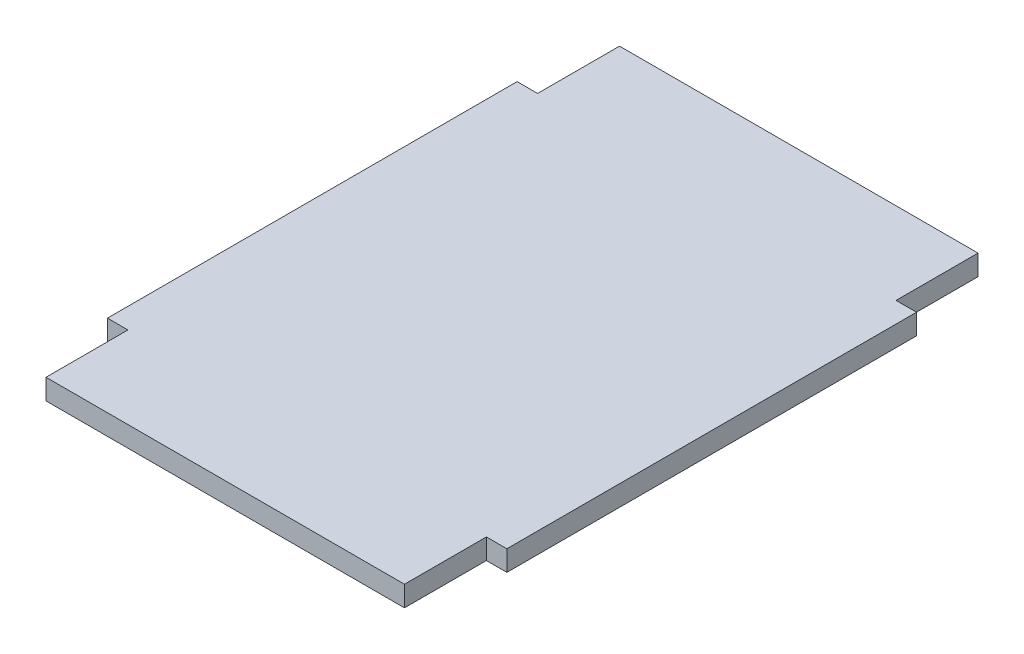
SolidWorks part; units mm, degrees
ref_plane "Front" through (0, 0, 0) normal (0, 0, 1) x (1, 0, 0)
ref_plane "Top" through (0, 0, 0) normal (0, 1, 0) x (1, 0, 0)
ref_plane "Right" through (0, 0, 0) normal (1, 0, 0) x (0, 0, -1)
sketch "草图1" plane through (0, 0, 0) normal (0, 1, 0) x (1, 0, 0)
  line L1 (0, 0) -> (35, 0)
  line L2 (0, 0) -> (0, 56)
  line L3 (0, 56) -> (35, 56)
  line L4 (35, 0) -> (35, 56)
  line L5 (0, 48) -> (-2, 48)
  line L6 (0, 48) -> (0, 8)
  line L7 (0, 8) -> (-2, 8)
  line L8 (-2, 48) -> (-2, 8)
  line L9 (35, 48) -> (37, 48)
  line L10 (35, 48) -> (35, 8)
  line L11 (35, 8) -> (37, 8)
  line L12 (37, 48) -> (37, 8)
  dimension "D1" = 35
  dimension "D2" = 40
  dimension "D3" = 56
  dimension "D4" = 8
  dimension "D5" = 2
  dimension "D6" = 2
  dimension "D7" = 8
  dimension "D8" = 40
extrude "凸台-拉伸1" add sketch "草图1" along normal blind 2 contours L5 L8 L7 L2 | L1 L4 L3 L2 | L12 L9 L4 L11
